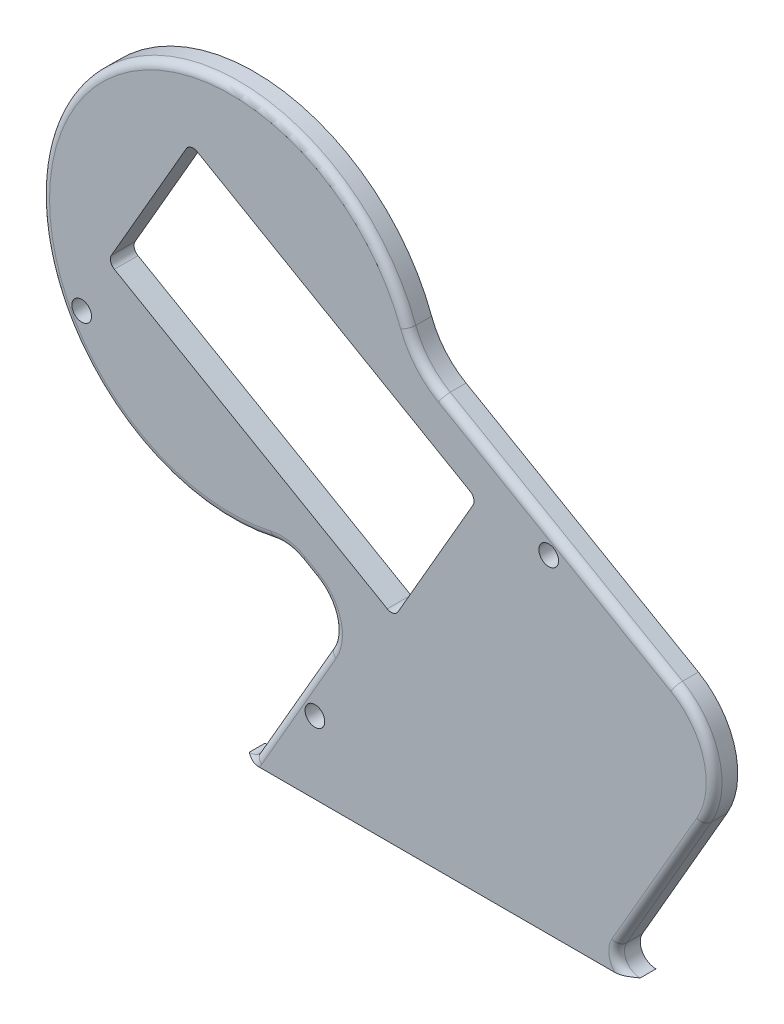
SolidWorks part; units mm, degrees
ref_plane "Front Plane" through (0, 0, 0) normal (0, 0, 1) x (1, 0, 0)
ref_plane "Top Plane" through (0, 0, 0) normal (0, 1, 0) x (1, 0, 0)
ref_plane "Right Plane" through (0, 0, 0) normal (1, 0, 0) x (0, 0, -1)
sketch "Sketch1" plane through (0, 0, 0) normal (0, 0, 1) x (1, 0, 0)
  line L0 (-14.3301, 24.1506) -> (-16.0845, 25.1635) construction
  line L1 (-21.9226, 1) -> (-12.5, 17.3205) construction
  line L2 (61, 0) -> (-61, 0) construction
  line L3 (35, 21.6506) -> (24.2321, 3) construction
  line L4 (1.8578, 52.3323) -> (31.3397, 35.3109) construction
  line L5 (-14.3301, 24.1506) -> (-16.0845, 25.1635)
  line L6 (-21.9226, 1) -> (-12.5, 17.3205)
  line L7 (25.9641, 0) -> (-23.6547, 0)
  line L8 (35, 21.6506) -> (24.2321, 3)
  line L9 (1.8578, 52.3323) -> (31.3397, 35.3109)
  arc A5 (24.2321, 3) -> (25.9641, 0) centre (25.9641, 2) ccw construction
  arc A6 (-2.5121, 57.4991) -> (-19.6906, 25.7095) centre (-25, 49.1149) ccw construction
  arc A13 (-2.5121, 57.4991) -> (-19.6906, 25.7095) centre (-25, 49.1149) ccw
  arc A16 (35, 21.6506) -> (31.3397, 35.3109) centre (26.3397, 26.6506) ccw construction
  arc A17 (-2.5121, 57.4991) -> (1.8578, 52.3323) centre (6.8578, 60.9925) ccw construction
  arc A18 (-16.0845, 25.1635) -> (-19.6906, 25.7095) centre (-18.5845, 20.8334) ccw construction
  arc A19 (-12.5, 17.3205) -> (-14.3301, 24.1506) centre (-16.8301, 19.8205) ccw construction
  arc A20 (-23.6547, 0) -> (-21.9226, 1) centre (-23.6547, 2) ccw construction
  arc A21 (24.2321, 3) -> (25.9641, 0) centre (25.9641, 2) ccw
  arc A22 (35, 21.6506) -> (31.3397, 35.3109) centre (26.3397, 26.6506) ccw
  arc A23 (-2.5121, 57.4991) -> (1.8578, 52.3323) centre (6.8578, 60.9925) ccw
  arc A24 (-16.0845, 25.1635) -> (-19.6906, 25.7095) centre (-18.5845, 20.8334) ccw
  arc A25 (-12.5, 17.3205) -> (-14.3301, 24.1506) centre (-16.8301, 19.8205) ccw
  arc A26 (-23.6547, 0) -> (-21.9226, 1) centre (-23.6547, 2) ccw
extrude "Boss-Extrude1" add sketch "Sketch1" along normal blind 3 contours A13 A24 L5 A25 L6 A26 L7 A21 L8 A22 L9 A23
fillet "Fillet1" radius 1 11 edges at (29.616, 12.3253, 3) (16.5988, 43.8216, 3) (-17.2113, 9.1603, 3) (-15.2073, 24.6571, 3) (-46.1144, 60.5247, 3) (24.2321, 1, 3) (35.999, 29.2388, 3) (-0.7775, 54.5348, 3) (-22.6547, 0.2679, 3) (-12.0005, 21.1146, 3) (-17.836, 25.7771, 3)
hole_wizard "M3 Tapped Hole1" positions "Sketch2" profile "Sketch3" tap size "M3" standard "ISO"
sketch "Sketch2" plane through (0, 0, 3) normal (0, 0, 1) x (1, 0, 0)
  point P0 (-43.9149, 38.8936)
  point P3 (15.3488, 41.6565)
  point P6 (-14.3246, 9.1603)
sketch "Sketch3" plane through (-43.9149, 38.8936, 3) normal (1, 0, 0) x (0, -1, 0)
  line L0 (0, 0) -> (0, 3)
  line L1 (0, 3) -> (1.25, 3)
  line L2 (1.25, 3) -> (1.25, 0)
  line L5 (1.25, 0) -> (0, 0)
  line L11 (0, -6.35) -> (0, 107.95) construction
  dimension "Thru Tap Drill Dia." = 2.5
  dimension "Thru Tap Drill Depth" = 3
sketch "Sketch4" plane through (0, 0, 3) normal (0, 0, 1) x (1, 0, 0)
  line L8 (-30.1423, 64.2081) -> (-40.6423, 46.0216)
  line L9 (6.2308, 43.2081) -> (-30.1423, 64.2081)
  line L10 (-4.2692, 25.0216) -> (6.2308, 43.2081)
  line L11 (-40.6423, 46.0216) -> (-4.2692, 25.0216)
  line L12 (-30.1423, 64.2081) -> (-40.6423, 46.0216)
  line L13 (6.2308, 43.2081) -> (-30.1423, 64.2081)
  line L14 (-4.2692, 25.0216) -> (6.2308, 43.2081)
  line L15 (-40.6423, 46.0216) -> (-4.2692, 25.0216)
  dimension "D2" = 0
extrude "Cut-Extrude3" cut sketch "Sketch4" along normal through all from surface at -3
fillet "Fillet2" radius 1 4 edges at (-30.1423, 64.2081, 1.5) (6.2308, 43.2081, 1.5) (-40.6423, 46.0216, 1.5) (-4.2692, 25.0216, 1.5)
